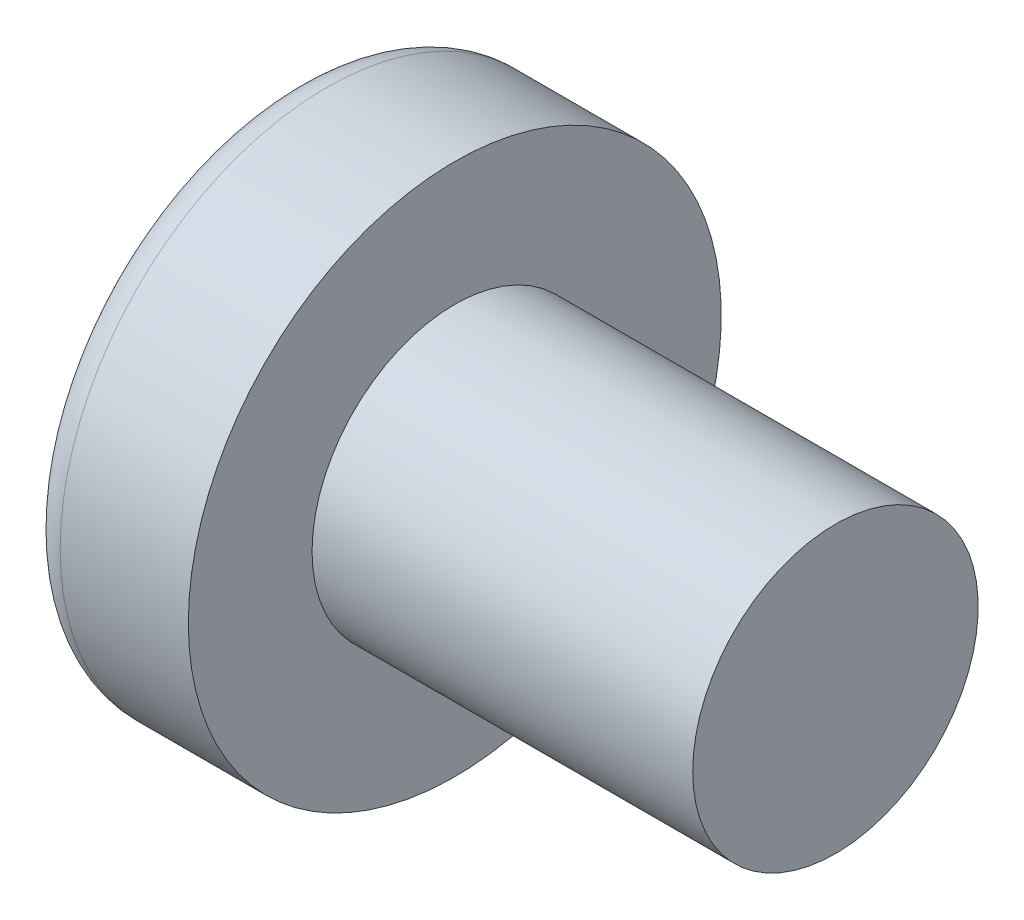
SolidWorks part; units mm, degrees
ref_plane "Plane1" through (0, 0, 0) normal (0, 0, 1) x (1, 0, 0)
ref_plane "Plane2" through (0, 0, 0) normal (0, 1, 0) x (1, 0, 0)
ref_plane "Plane3" through (0, 0, 0) normal (1, 0, 0) x (0, 0, -1)
sketch "BodySke" plane through (0, 0, 0) normal (0, 0, 1) x (1, 0, 0)
  line L0 (2.4, 1.5) -> (2.4, 2.8)
  line L1 (2.9, 6.35) -> (2.9, -3.175) construction
  line L2 (-25.4, 0) -> (127, 0) construction
  line L3 (6.4, 0) -> (0, 0)
  line L4 (2.4, 1.5) -> (6.4, 1.5)
  line L5 (6.4, 1.5) -> (6.4, 0)
  line L6 (1.0534, 2.8) -> (2.4, 2.8)
  line L7 (2.4, -1.5) -> (6.4, -1.5) construction
  line L8 (2.4, 6.35) -> (2.4, -3.175) construction
  arc A0 (0.7472, 2.6293) -> (0, 0) centre (5, 0) ccw
  arc A2 (0.7472, 2.6293) -> (1.0534, 2.8) centre (1.0534, 2.44) cw
revolve "Base-Revolve" add sketch "BodySke" angle 360 about L2
sketch "Sketch3" plane through (0, 0, 0) normal (1, 0, 0) x (0, 0, -1)
  line L0 (0.37, -1.45) -> (-0.37, -1.45)
  line L1 (0.37, -1.45) -> (0.37, 1.45)
  line L2 (-0.37, 1.45) -> (0.37, 1.45)
  line L3 (-0.37, 1.45) -> (-0.37, -1.45)
ref_plane "Plane4" through (1.76, 0, 0) normal (1, 0, 0) x (0, 0, -1)
sketch "Sketch4" plane through (1.76, 0, 0) normal (1, 0, 0) x (0, 0, -1)
  line L0 (0.185, -0.185) -> (-0.185, -0.185)
  line L1 (0.185, -0.185) -> (0.185, 0.185)
  line L2 (-0.185, 0.185) -> (0.185, 0.185)
  line L3 (-0.185, 0.185) -> (-0.185, -0.185)
loft "Cut-Loft1" cut profiles "Sketch3", "Sketch4"
pattern_circular "CirPattern1" count 2 every 90 about axis through (0, 0, 0) along (1, 0, 0) of "Cut-Loft1"
sketch "ThdSchSke" plane through (0, 0, 0) normal (0, 0, 1) x (1, 0, 0)
  line L0 (2.9, -1.2195) -> (2.7036, -1.5)
  line L1 (2.9, -1.2195) -> (3.0964, -1.5)
  line L2 (3.0964, -1.5) -> (3.0964, -1.875)
  line L3 (-3.175, 0) -> (5.1513, 0) construction
  line L5 (3.0964, -1.875) -> (2.7036, -1.875)
  line L6 (2.7036, -1.875) -> (2.7036, -1.5)
revolve "ThreadSchematic" [suppressed] cut sketch "ThdSchSke" angle 360 about L3
pattern_linear "ThdSchPat" [suppressed]
equation "\"D1@Sketch3\" = \"Cross_dia@Sketch3\" / 2"
equation "\"D2@Sketch3\" = \"Cross_width@Sketch3\" / 2"
equation "\"D1@Sketch4\" = \"Cross_width@Sketch3\" *.5"
equation "\"D2@Sketch4\" = \"D1@Sketch4\""
equation "\"D3@Sketch4\" = \"D1@Sketch4\" / 2"
equation "\"D4@Sketch4\" = \"D2@Sketch4\" / 2"
equation "\"Thread_length@ThreadCosmetic\" = ((sgn( (\"Length@BodySke\" - \"Advance@BodySke\" ) - \"Thread_nom@BodySke\" )-1)*( (\"Length@BodySke\" - \"Advance@BodySke\" ) - \"Thread_nom@BodySke\" ))/-2+ \"Thread_nom@BodySke\""
equation "\"Thread_minor@ThdSchSke\" = \"Thread_minor@ThreadCosmetic\""
equation "\"Diameter@ThdSchSke\" = \"Diameter@BodySke\""
equation "\"Overcut@ThdSchSke\" = \"Diameter@BodySke\" * 1.25"
equation "\"Start@ThdSchSke\" = \"Head_ht@BodySke\" + \"Length@BodySke\" - \"Thread_length@ThreadCosmetic\"  '---Non-countersunk---"
equation "\"Num_threads@ThdSchPat\" = int( \"Thread_length@ThreadCosmetic\" / \"Advance@BodySke\" + 0.999 )  + 1"
equation "\"Advance@ThdSchPat\" = \"Thread_length@ThreadCosmetic\" /  (\"Num_threads@ThdSchPat\" - 1) 'relax it"
